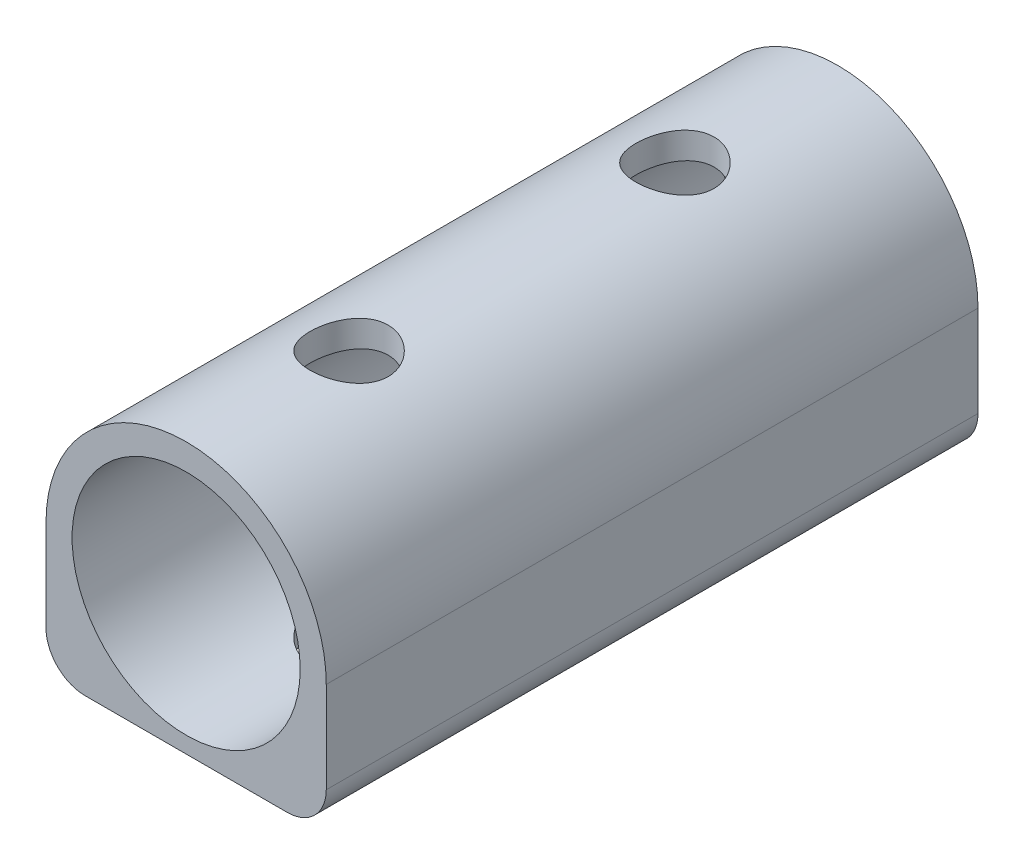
SolidWorks part; units mm, degrees
extrude "Base-Extrude" add sketch "Sketch1" along normal blind 100
sketch "Sketch1" plane through (0, 0, 0) normal (0, 0, 1) x (1, 0, 0)
  line L0 (-21.5, -20) -> (-21.5, 0)
  line L1 (21.5, 0) -> (21.5, -20)
  line L2 (21.5, -20) -> (-21.5, -20)
  arc A0 (-21.5, 0) -> (21.5, 0) centre (0, 0) cw
  dimension "D1" = 20
  dimension "Outer_D" = 43
ref_plane "Plane1" through (0, 0, 0) normal (0, 0, 1) x (1, 0, 0)
ref_plane "Plane2" through (0, 0, 0) normal (0, 1, 0) x (1, 0, 0)
ref_plane "Plane3" through (0, 0, 0) normal (1, 0, 0) x (0, 0, -1)
sketch "Sketch2" plane through (0, 0, 100) normal (0, 0, 1) x (1, 0, 0)
  circle A0 centre (0, 0) radius 17.5
extrude "Cut-Extrude1" cut sketch "Sketch2" against normal through all
sketch "Sketch3" plane through (0, -20, 0) normal (0, -1, 0) x (1, 0, 0)
  line L0 (21.5, 100) -> (-21.5, 100) construction
  line L3 (21.5, 100) -> (-21.5, 100) construction
  circle A0 centre (0, 25) radius 6
  circle A1 centre (0, 75) radius 6
extrude "Cut-Extrude2" cut sketch "Sketch3" against normal through all
fillet "Fillet1" radius 6 2 edges at (21.5, -20, 50) (-21.5, -20, 50)
equation "\"Hole1@Sketch3\" = \"Length@Base-Extrude\" / 4'Hole1 placement"
equation "\"Hole2@Sketch3\"= \"Length@Base-Extrude\" * 3 / 4 'Hole2 placement"
equation "\"ThinnestWall\"= 4"
equation "\"Outer_D@Sketch1\"=\"Inner_D@Sketch2\"+\"ThinnestWall\"*2"
